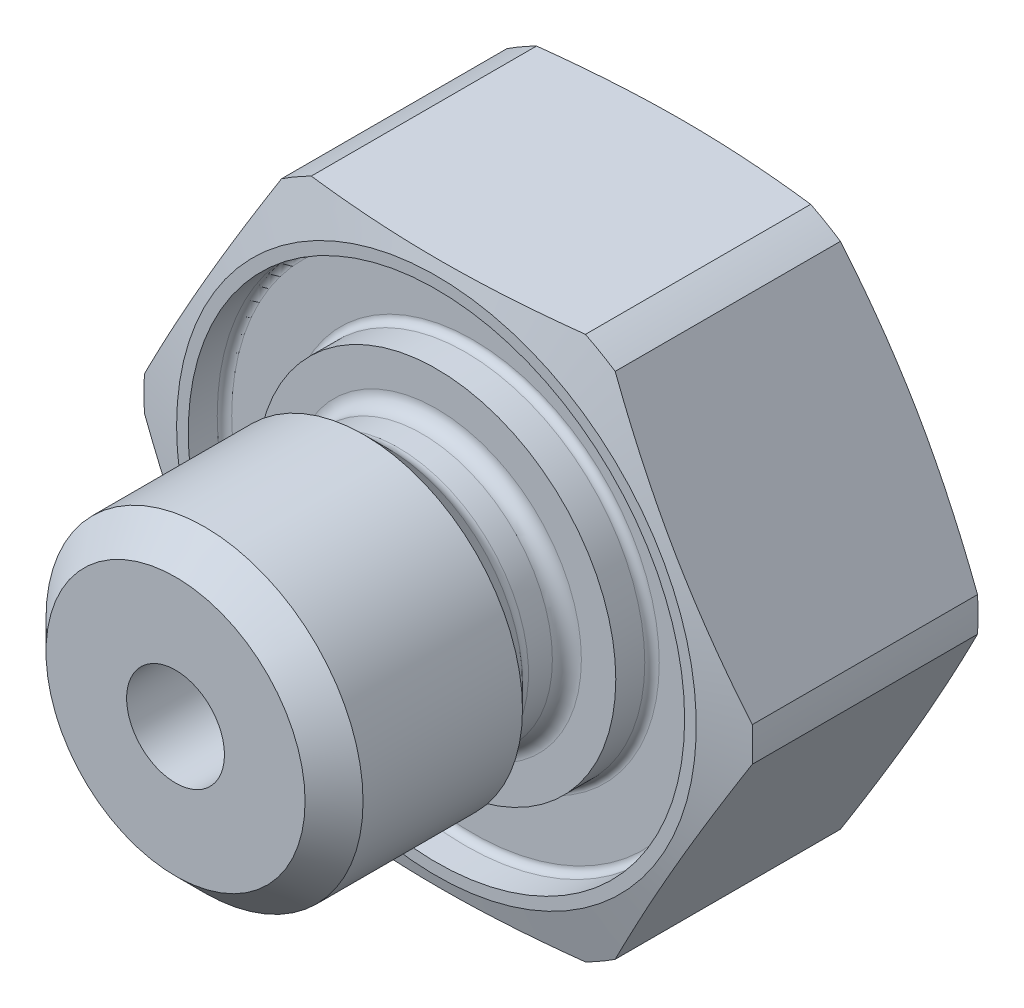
SolidWorks part; units mm, degrees
ref_plane "Front" through (0, 0, 0) normal (0, 0, 1) x (1, 0, 0)
ref_plane "Top" through (0, 0, 0) normal (0, 1, 0) x (1, 0, 0)
ref_plane "Right" through (0, 0, 0) normal (1, 0, 0) x (0, 0, -1)
imported_body "Imported1"
sketch "Sketch1" plane through (0, 0, 0) normal (1, 0, 0) x (0, 0, -1)
  line L0 (-21.3749, 0) -> (34.5632, 0) construction
  line L1 (-8.128, 0) -> (-2.54, 0) construction
  line L2 (8.7582, 0) -> (8.7312, -8.382)
  line L3 (8.7312, -9.1073) -> (8.7312, 9.1073) construction
  line L4 (8.7312, -8.382) -> (5.1752, -8.382)
  line L5 (5.1752, -8.382) -> (4.9229, -8.128)
  line L6 (4.9229, -8.128) -> (4.414, -8.128)
  line L7 (4.414, -8.128) -> (4.414, -7.493)
  line L8 (4.414, -7.493) -> (2.6381, -7.493)
  line L9 (2.6381, -7.493) -> (2.6381, -4.064)
  line L10 (2.6377, 0) -> (8.7582, 0)
  line L11 (2.6381, -4.064) -> (-1.4314, -1.7145)
  line L12 (-1.4314, -1.7145) -> (-9.144, -1.7145)
  line L13 (-9.144, 4.5402) -> (-9.144, -4.5402) construction
  line L14 (-9.144, -1.7145) -> (-9.144, 0)
  line L15 (-9.144, 0) -> (2.6377, 0)
  line L16 (0, 9.1073) -> (0, -9.1073) construction
  line L17 (0, -6.2865) -> (1.27, -6.2865)
  line L18 (0, -6.2865) -> (0, -8.6995)
  line L19 (0, -8.6995) -> (1.27, -8.6995)
  line L20 (1.27, -6.2865) -> (1.27, -8.6995)
  dimension "D1" = 16.764
  dimension "D2" = 3.556
  dimension "D3" = 45
  dimension "D4" = 16.256
  dimension "D5" = 4.318
  dimension "D6" = 6.096
  dimension "D7" = 3.429
  dimension "D8" = 30
  dimension "D9" = 12.573
  dimension "D10" = 2.413
  dimension "D11" = 1.27
  dimension "D12" = 8.128
  dimension "D13" = 14.986
revolve "Cut-Revolve1" cut sketch "Sketch1" angle 360 about L0
chamfer "Chamfer1" distance 0.381 angle 45
fillet "Fillet1" radius 0.127
fillet "Fillet2" radius 0.254
fillet "Fillet3" radius 0.508
fillet "Fillet4" radius 0.508
fillet "Fillet5" radius 0.508
sketch "Sketch2" plane through (0, 0, -8.7312) normal (0, 0, -1) x (-1, 0, 0)
  circle A0 centre (0, 0) radius 10.668
  dimension "D1" = 21.336
extrude "Cut-Extrude1" cut sketch "Sketch2" against normal blind 10 flip side to cut
